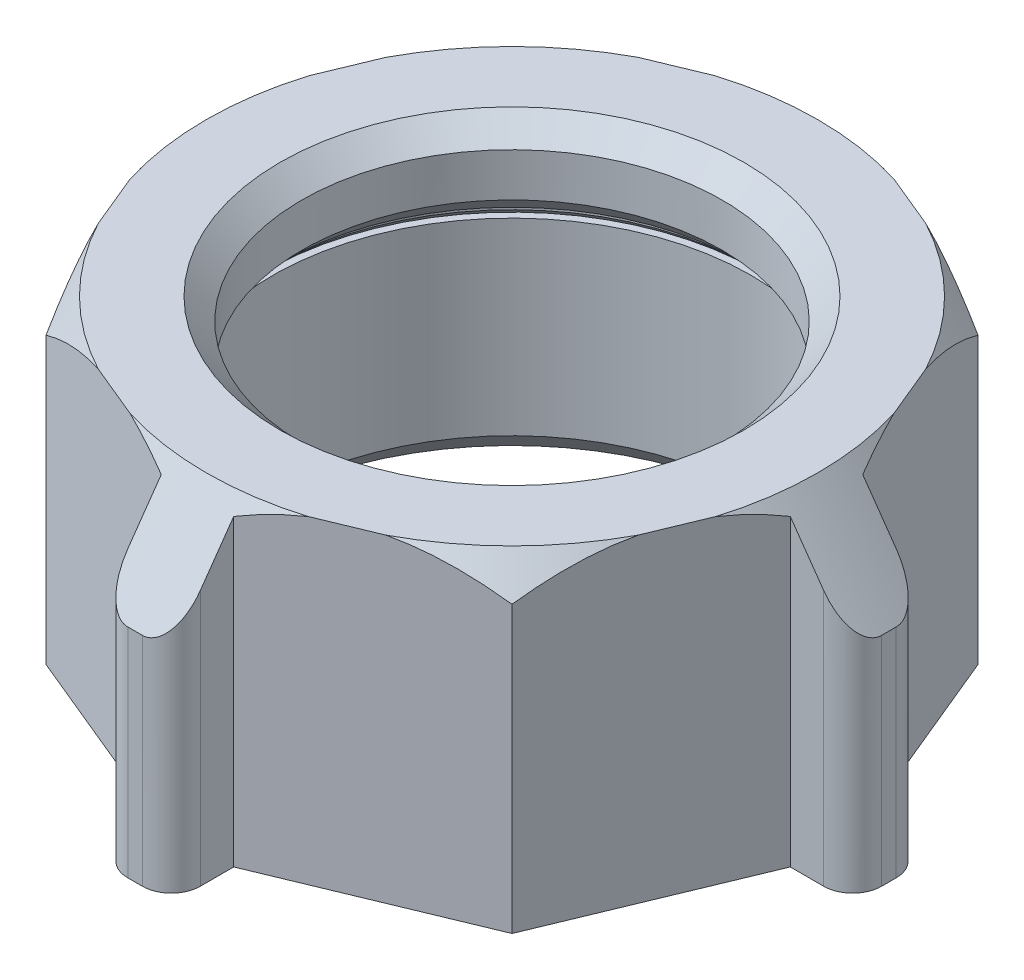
SolidWorks part; units mm, degrees
ref_plane "Anteriore" through (0, 0, 0) normal (0, 0, 1) x (1, 0, 0)
ref_plane "Superiore" through (0, 0, 0) normal (0, 1, 0) x (1, 0, 0)
ref_plane "Destro" through (0, 0, 0) normal (1, 0, 0) x (0, 0, -1)
sketch "Schizzo1" plane through (0, 0, 0) normal (0, 1, 0) x (1, 0, 0)
  line L1 (22.7302, 0) -> (16.0727, 16.0727)
  line L2 (16.0727, 16.0727) -> (0, 22.7302)
  line L3 (0, 22.7302) -> (-16.0727, 16.0727)
  line L4 (-16.0727, 16.0727) -> (-22.7302, 0)
  line L5 (-22.7302, 0) -> (-16.0727, -16.0727)
  line L6 (-16.0727, -16.0727) -> (0, -22.7302)
  line L7 (0, -22.7302) -> (16.0727, -16.0727)
  line L8 (16.0727, -16.0727) -> (22.7302, 0)
  circle A0 centre (0, 0) radius 21 construction
  dimension "D1" = 42
extrude "Estrusione1" add sketch "Schizzo1" along normal blind 22
sketch "Schizzo2" plane through (0, 22, 0) normal (0, 1, 0) x (-1, 0, 0)
  circle A0 centre (0, 0) radius 14.5
  dimension "D1" = 29
extrude "Taglio-Estrusione1" cut sketch "Schizzo2" against normal through all
sketch "Schizzo3" plane through (0, 0, 0) normal (0, -1, 0) x (1, 0, 0)
  circle A0 centre (0, 0) radius 16.5
  dimension "D1" = 33
extrude "Taglio-Estrusione2" cut sketch "Schizzo3" against normal blind 16
sketch "Schizzo4" plane through (0, 0, 0) normal (0, 0, 1) x (1, 0, 0)
  line L1 (18.7302, 22) -> (26, 22)
  line L2 (18.7302, 22) -> (18.7302, 0)
  line L3 (18.7302, 0) -> (26, 0)
  line L4 (26, 22) -> (26, 0)
  line L5 (16.0727, 22) -> (0, 22) construction
  line L6 (16.0727, 0) -> (0, 0) construction
  line L7 (22.7302, 22) -> (22.7302, 0) construction
  dimension "D1" = 26
  dimension "D2" = 4
extrude "Estrusione2" add sketch "Schizzo4" along normal mid plane 5
fillet "Raccordo1" radius 2 2 edges at (26, 11, -2.5) (26, 11, 2.5)
pattern_circular "RipetizioneCircolare1" count 4 over 360 about axis through (0, 0, 0) along (0, 1, 0) of "Estrusione2", "Raccordo1"
sketch "Schizzo5" plane through (0, 0, 0) normal (0, 0, 1) x (1, 0, 0)
  line L0 (17.5975, 27) -> (31, 7.8593)
  line L1 (31, 7.8593) -> (31, 27)
  line L2 (31, 27) -> (17.5975, 27)
  line L3 (24, 22) -> (21.6947, 22) construction
  line L4 (26, 0) -> (26, 22) construction
  line L5 (13.5, 23) -> (17, 23)
  line L6 (17, 23) -> (13.5, 19.5)
  line L7 (13.5, 19.5) -> (13.5, 23)
  line L8 (14.5, 16) -> (14.5, 22) construction
  line L9 (2.5, 22) -> (16.0727, 22) construction
  line L10 (14.5, 19) -> (0, 19) construction
  line L11 (0, 16) -> (0, 22) construction
  line L12 (17, 15) -> (13.5, 18.5)
  line L13 (13.5, 15) -> (17, 15)
  line L14 (13.5, 18.5) -> (13.5, 15)
  line L15 (19.5, -1) -> (15, 3.5)
  line L16 (15, 3.5) -> (15, -1)
  line L17 (15, -1) -> (19.5, -1)
  line L18 (16.5, 0) -> (16.5, 16) construction
  line L19 (16.0727, 0) -> (21.6947, 0) construction
  point P7 (26, 15)
  point P11 (14.5, 20.5)
  point P26 (16.5, 2)
  dimension "D1" = 5
  dimension "D2" = 5
  dimension "D3" = 35
  dimension "D4" = 7
  dimension "D5" = 1.5
  dimension "D6" = 1
  dimension "D7" = 1
  dimension "D8" = 45
  dimension "D9" = 2
  dimension "D10" = 1.5
  dimension "D11" = 45
  dimension "D12" = 1
revolve "Taglia-Rivoluzione1" cut sketch "Schizzo5" angle 360 about axis through (0, 0, 0) along (0, 1, 0)
